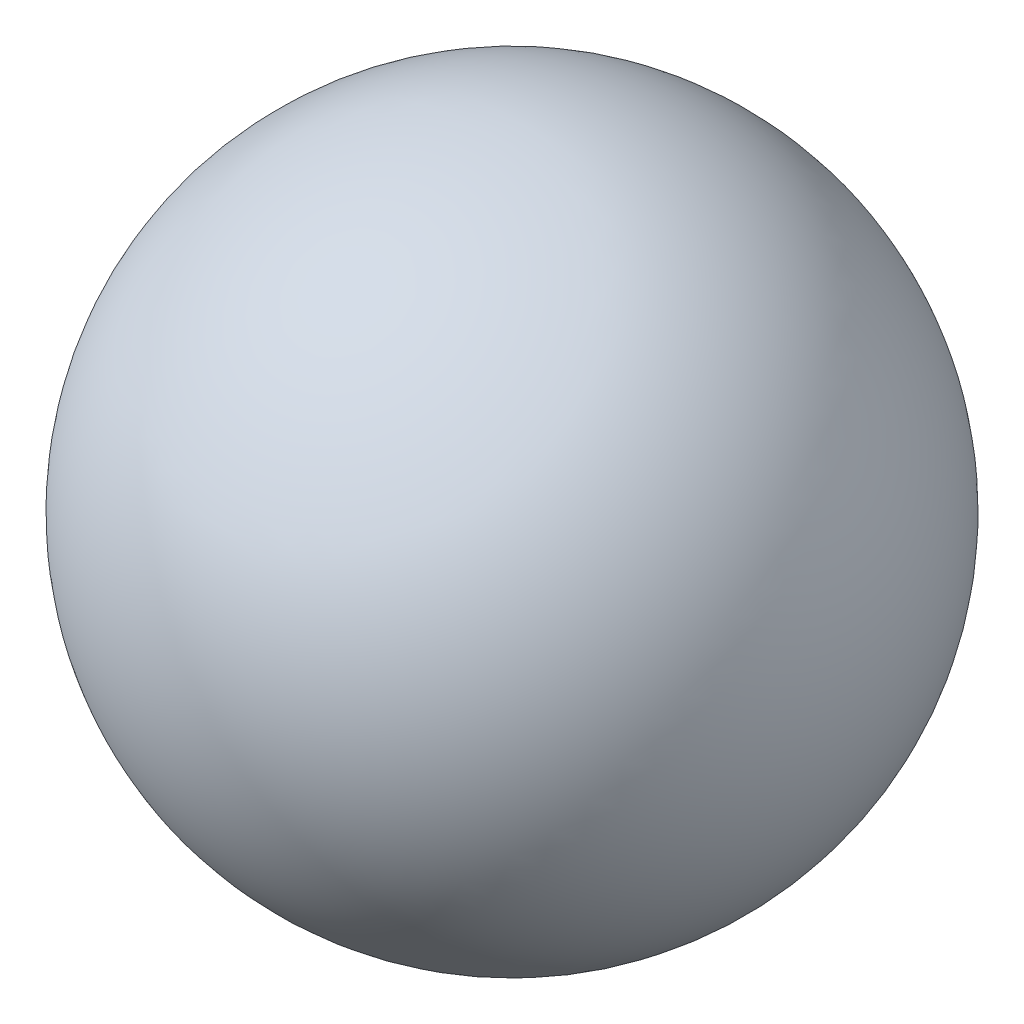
SolidWorks part; units mm, degrees
ref_plane "Front" through (0, 0, 0) normal (0, 0, 1) x (1, 0, 0)
ref_plane "Top" through (0, 0, 0) normal (0, 1, 0) x (1, 0, 0)
ref_plane "Right" through (0, 0, 0) normal (1, 0, 0) x (0, 0, -1)
sketch "Эскиз1" plane through (0, 0, 0) normal (0, 1, 0) x (1, 0, 0)
  line L0 (0, 2) -> (0, -2)
  line L1 (0, 0) -> (0, 4.4021) construction
  arc A0 (0, -2) -> (0, 2) centre (0, 0) ccw
  dimension "D1" = 4
revolve "Повернуть1" add sketch "Эскиз1" angle 360 about L1
